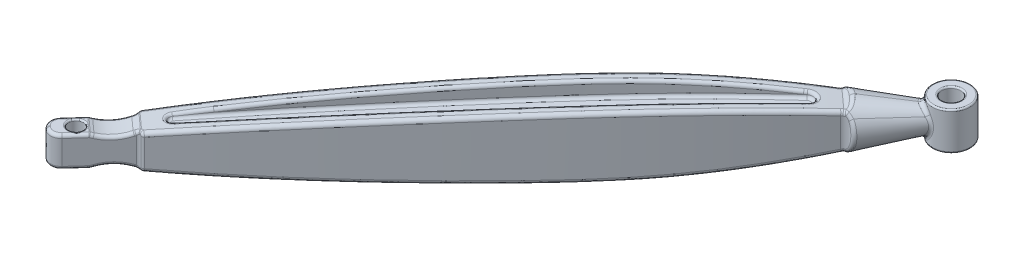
SolidWorks part; units mm, degrees
ref_plane "Plan de face" through (0, 0, 0) normal (0, 0, 1) x (1, 0, 0)
ref_plane "Plan de dessus" through (0, 0, 0) normal (0, 1, 0) x (1, 0, 0)
ref_plane "Plan de droite" through (0, 0, 0) normal (1, 0, 0) x (0, 0, -1)
imported_body "Importée1"
sketch "Esquisse1" plane through (0, 0, 0) normal (0, 1, 0) x (1, 0, 0)
  line L0 (-157.4219, -1189.6405) -> (-129.2614, -1158.3651)
  line L1 (-129.2614, -1158.3651) -> (-126.2888, -1161.0416)
  line L2 (-126.2888, -1161.0416) -> (-154.4493, -1192.317)
  line L3 (-154.4493, -1192.317) -> (-157.4219, -1189.6405)
  line L4 (-211.7629, -1255.9702) -> (-165.0253, -1204.0629) construction
  line L5 (-154.4493, -1192.317) -> (-781.2606, -1888.4616) construction
  dimension "D1" = 4
revolve "Enlèvement de matière-Révolution2" cut sketch "Esquisse1" angle 360 about L5
sketch "Esquisse2" plane through (0, 0, 0) normal (0, 1, 0) x (1, 0, 0)
  line L0 (-737.4622, -1839.8184) -> (-702.267, -1800.7302)
  line L1 (-737.4622, -1839.8184) -> (-739.6916, -1837.8111)
  line L2 (-702.267, -1800.7302) -> (-704.4965, -1798.7228)
  line L3 (-739.6916, -1837.8111) -> (-704.4965, -1798.7228)
  line L4 (-154.4493, -1192.317) -> (-781.2606, -1888.4616) construction
  dimension "D1" = 3
revolve "Enlèvement de matière-Révolution3" cut sketch "Esquisse2" angle 360 about L0
